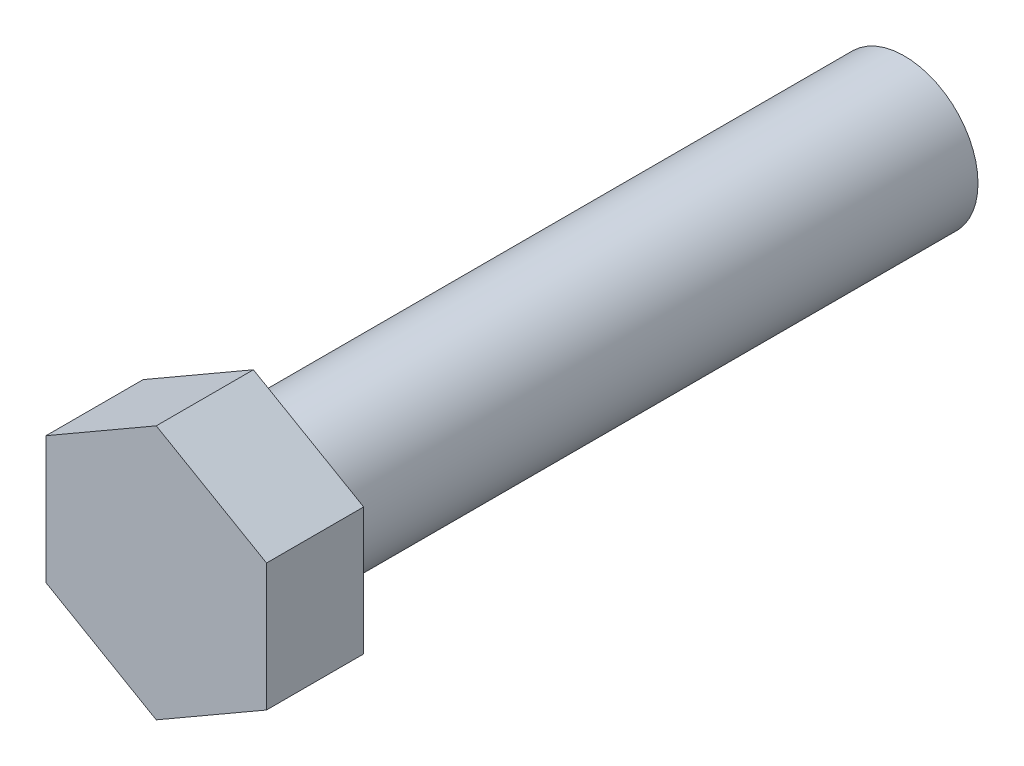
SolidWorks part; units mm, degrees
ref_plane "Front Plane" through (0, 0, 0) normal (1, 0, 0) x (0, 1, 0)
ref_plane "Top Plane" through (0, 0, 0) normal (0, 0, 1) x (0, 1, 0)
ref_plane "Right Plane" through (0, 0, 0) normal (0, 1, 0) x (-1, 0, 0)
sketch "Sketch1"
sketch_block_instance "W14x730-1-1"
sketch_block "W14x730-1" parameters "D4"=15.24, "D1"=454.406, "D2"=569.468, "D3"=77.978, "D5"=124.714, "D6"=533.4, "D7"=27.3509, "D8"=8374.3758, "D9"=3499.6788, "D10"=18059.4
sketch "sk body" plane through (0, 0, 0) normal (0, 0, 1) x (0, 1, 0)
  circle A0 centre (0, 0) radius 44.45
  dimension "D1" = 88.9
sketch "sk Max dia" plane through (0, 0, 0) normal (0, 0, 1) x (0, 1, 0)
  circle A0 centre (0, 0) radius 52.2097
  dimension "D1" = 104.4194
sketch "Sketch3" plane through (0, 0, 0) normal (0, 0, 1) x (0, 1, 0)
  line L1 (76.9897, 0) -> (38.4948, 66.675)
  line L2 (38.4948, 66.675) -> (-38.4948, 66.675)
  line L3 (-38.4948, 66.675) -> (-76.9897, 0)
  line L4 (-76.9897, 0) -> (-38.4948, -66.675)
  line L5 (-38.4948, -66.675) -> (38.4948, -66.675)
  line L6 (38.4948, -66.675) -> (76.9897, 0)
  circle A0 centre (0, 0) radius 66.675 construction
  dimension "D1" = 133.35
extrude "bolt Head" add sketch "Sketch3" along normal blind 58.7375
extrude "bolt Body" add sketch "sk body" against normal blind 393.7
